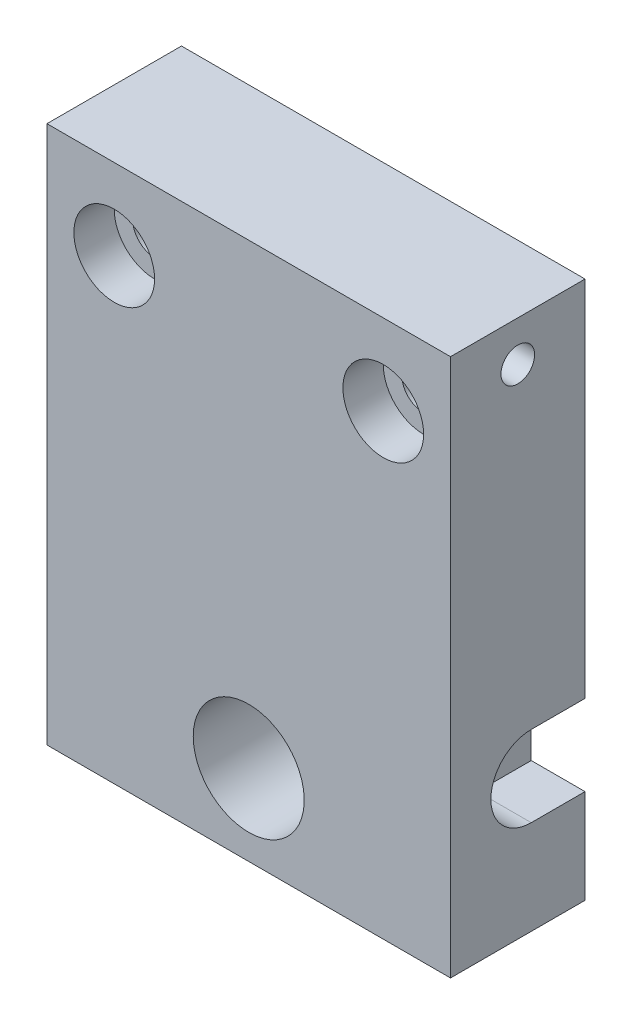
SolidWorks part; units mm, degrees
other "Objet de détail1"
ref_plane "Plan de face" through (0, 0, 0) normal (0, 0, 1) x (1, 0, 0)
ref_plane "Plan de dessus" through (0, 0, 0) normal (0, 1, 0) x (1, 0, 0)
ref_plane "Plan de droite" through (0, 0, 0) normal (1, 0, 0) x (0, 0, -1)
sketch "Esquisse1" plane through (0, 0, 0) normal (0, 1, 0) x (1, 0, 0)
  line L1 (-30, 0) -> (30, 0)
  line L2 (-30, 0) -> (-30, 20)
  line L3 (-30, 20) -> (30, 20)
  line L4 (30, 0) -> (30, 20)
  dimension "D1" = 20
  dimension "D2" = 60
extrude "Extrusion1" add sketch "Esquisse1" along normal blind 80
hole_wizard "Chambrage pour axes 6.5 mm3" positions "Esquisse3" profile "Esquisse2" counterbore size "6.5" standard "HASCO Métrique"
sketch "Esquisse3" plane through (0, 0, 0) normal (0, 0, 1) x (1, 0, 0)
  line L3 (-30, 80) -> (30, 80) construction
  line L4 (-30, 80) -> (-30, 0) construction
  point P3 (-20, 68)
  point P5 (20, 68)
  dimension "D1" = 12
  dimension "D2" = 10
  dimension "D3" = 40
sketch "Esquisse2" plane through (-20, 68, 0) normal (1, 0, 0) x (0, -1, 0)
  line L0 (0, 0) -> (0, 20)
  line L1 (0, 20) -> (3.25, 20)
  line L3 (3.25, 20) -> (3.25, 6)
  line L4 (3.25, 6) -> (6, 6)
  line L5 (6, 6) -> (6, 0)
  line L7 (6, 0) -> (0, 0)
  line L11 (0, -6.35) -> (0, 107.95) construction
  dimension "Diamètre du perçage jusqu'au prochain" = 6.5
  dimension "Profondeur du perçage jusqu'au prochain" = 20
  dimension "Diamètre du chambrage" = 12
  dimension "Profondeur du chambrage" = 6
hole_wizard "Trou taraudé M61" positions "Esquisse5" profile "Esquisse4" tap size "M6" standard "ISO"
sketch "Esquisse5" plane through (30, 0, 0) normal (1, 0, 0) x (0, 0, -1)
  line L0 (0, 80) -> (0, 0) construction
  line L1 (0, 80) -> (20, 80) construction
  point P0 (10, 74)
  dimension "D1" = 10
  dimension "D2" = 6
sketch "Esquisse4" plane through (30, 74, -10) normal (0, 1, 0) x (0, 0, -1)
  line L0 (0, 0) -> (0, 17.5022)
  line L1 (0, 17.5022) -> (2.5, 16)
  line L2 (2.5, 16) -> (2.5, 0)
  line L5 (2.5, 0) -> (0, 0)
  line L10 (0, 17.5022) -> (-2.5, 16) construction
  line L11 (0, -6.35) -> (0, 107.95) construction
  dimension "Diamètre du trou pour taraudage" = 5
  dimension "Profondeur du trou pour taraudage" = 16
  dimension "Angle de pointe" = 118
hole_wizard "Trou taraudé M62" positions "Esquisse7" profile "Esquisse6" tap size "M6" standard "ISO"
sketch "Esquisse7" plane through (-30, 0, 0) normal (-1, 0, 0) x (0, 0, 1)
  point P0 (-10, 74)
sketch "Esquisse6" plane through (-30, 74, -10) normal (0, 1, 0) x (0, 0, 1)
  line L0 (0, 0) -> (0, 17.5022)
  line L1 (0, 17.5022) -> (2.5, 16)
  line L2 (2.5, 16) -> (2.5, 0)
  line L5 (2.5, 0) -> (0, 0)
  line L10 (0, 17.5022) -> (-2.5, 16) construction
  line L11 (0, -6.35) -> (0, 107.95) construction
  dimension "Diamètre du trou pour taraudage" = 5
  dimension "Profondeur du trou pour taraudage" = 16
  dimension "Angle de pointe" = 118
sketch "Esquisse8" plane through (30, 0, 0) normal (1, 0, 0) x (0, 0, -1)
  line L0 (0, 0) -> (20, 0) construction
  line L1 (0, 80) -> (0, 0) construction
  line L2 (12, 26) -> (20, 26)
  line L3 (20, 80) -> (20, 0) construction
  line L4 (20, 26) -> (20, 14)
  line L5 (20, 14) -> (12, 14)
  arc A0 (12, 26) -> (12, 14) centre (12, 20) ccw
  dimension "D2" = 12
  dimension "D1" = 20
  dimension "D3" = 12
extrude "Enlèv. mat.-Extru.1" cut sketch "Esquisse8" against normal blind 8
hole_wizard "Trou taraudé M18x1.51" positions "Esquisse10" profile "Esquisse9" tap size "M18x1.5" standard "ISO"
sketch "Esquisse10" plane through (0, 0, -20) normal (0, 0, -1) x (-1, 0, 0)
  line L0 (30, 80) -> (30, 0) construction
  line L1 (-30, 0) -> (30, 0) construction
  point P0 (0, 12)
  dimension "D1" = 30
  dimension "D2" = 12
sketch "Esquisse9" plane through (0, 12, -20) normal (1, 0, 0) x (0, 1, 0)
  line L0 (0, 0) -> (0, 48.4571)
  line L1 (0, 48.4571) -> (8.25, 43.5)
  line L2 (8.25, 43.5) -> (8.25, 0)
  line L5 (8.25, 0) -> (0, 0)
  line L10 (0, 48.4571) -> (-8.25, 43.5) construction
  line L11 (0, -6.35) -> (0, 107.95) construction
  dimension "Diamètre du trou pour taraudage" = 16.5
  dimension "Profondeur du trou pour taraudage" = 43.5
  dimension "Angle de pointe" = 118
